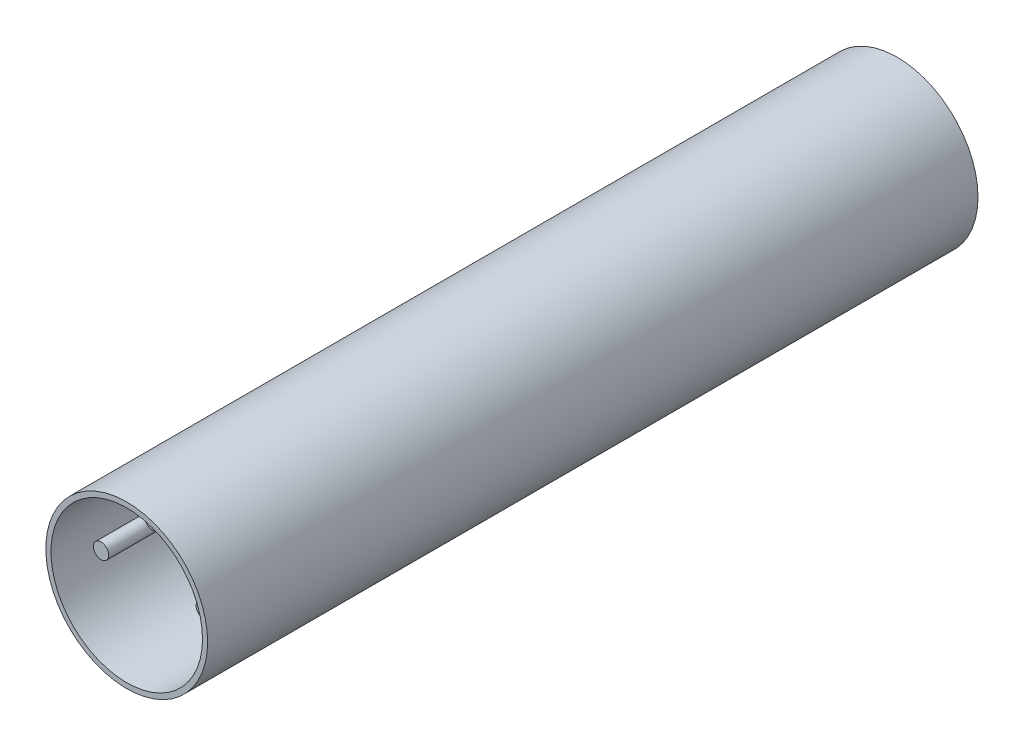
SolidWorks part; units mm, degrees
ref_plane "Front" through (0, 0, 0) normal (0, 0, 1) x (1, 0, 0)
ref_plane "Top" through (0, 0, 0) normal (0, 1, 0) x (1, 0, 0)
ref_plane "Right" through (0, 0, 0) normal (1, 0, 0) x (0, 0, -1)
sketch "Sketch1" plane through (0, 0, 0) normal (0, 0, 1) x (1, 0, 0)
  circle A0 centre (0, 0) radius 4.0005
  dimension "D1" = 8.001
extrude "Extrude1" add sketch "Sketch1" against normal blind 38.1
sketch "Sketch2" plane through (0, 0, 0) normal (0, 0, 1) x (1, 0, 0)
  circle A0 centre (0, 0) radius 3.7465
  dimension "D1" = 7.493
extrude "Cut-Extrude1" cut sketch "Sketch2" against normal blind 6.35
sketch "Sketch3" plane through (0, 0, -6.35) normal (0, 0, 1) x (1, 0, 0)
  line L0 (0, 0) -> (3.7465, 0) construction
  line L1 (0, 0) -> (0, 3.7465) construction
  circle A0 centre (0, 0) radius 3.7465 construction
  circle A1 centre (0, 2.54) radius 0.381
  circle A2 centre (2.54, 0) radius 0.381
  circle A3 centre (-2.54, 0) radius 0.381
  dimension "D1" = 0.762
  dimension "D2" = 2.54
  dimension "D3" = 2.54
extrude "Extrude2" add sketch "Sketch3" along normal blind 5.08 separate body
